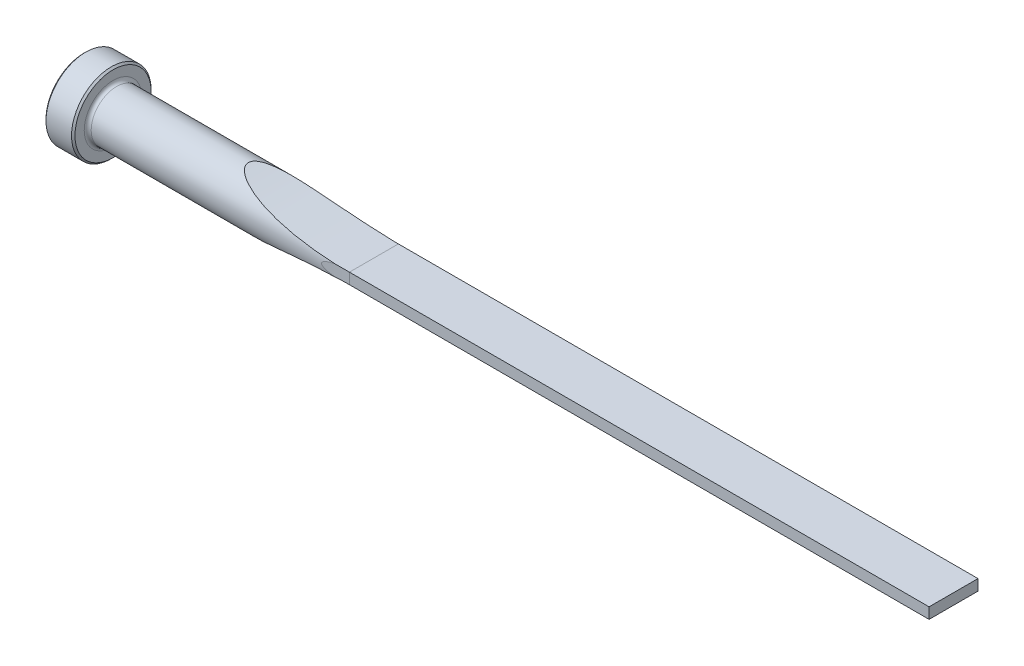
SolidWorks part; units mm, degrees
ref_plane "Front Plane" through (0, 0, 0) normal (0, 0, 1) x (1, 0, 0)
ref_plane "Top Plane" through (0, 0, 0) normal (0, 1, 0) x (1, 0, 0)
ref_plane "Right Plane" through (0, 0, 0) normal (1, 0, 0) x (0, 0, -1)
sketch "Sketch1" plane through (0, 0, 0) normal (0, 0, 1) x (1, 0, 0)
  line L0 (0, 0) -> (175.5286, 0) construction
  line L1 (0, 0) -> (0, 8.7249)
  line L2 (0, 8.7249) -> (6.35, 8.7249)
  line L3 (6.35, 8.7249) -> (6.35, 5.5562)
  line L4 (6.35, 5.5562) -> (190.5, 5.5562)
  line L5 (190.5, 5.5562) -> (190.5, 0)
  line L6 (190.5, 0) -> (0, 0)
  dimension "D1" = 190.5
  dimension "D2" = 17.4498
  dimension "D3" = 11.1125
  dimension "D4" = 6.35
revolve "Revolve1" add sketch "Sketch1" angle 360 about L0
sketch "Sketch2" plane through (0, 0, 0) normal (0, 0, 1) x (1, 0, 0)
  line L0 (190.5, 5.5562) -> (190.5, 1.1938)
  line L1 (190.5, -5.5562) -> (190.5, 5.5562) construction
  line L2 (190.5, 1.1938) -> (63.5, 1.1938)
  line L3 (190.5, 5.5562) -> (6.35, 5.5562) construction
  line L4 (35.9934, 5.5562) -> (190.5, 5.5562)
  line L5 (166.0833, 0) -> (153.1705, 0) construction
  arc A0 (63.5, 1.1938) -> (35.9934, 5.5562) centre (63.5, 90.0938) cw
  dimension "D1" = 88.9
  dimension "D3" = 127
  dimension "D2" = 2.3876
  dimension "D4" = 27.5066
extrude "Cut-Extrude1" cut sketch "Sketch2" against normal through all both and the other way through all
mirror "Mirror1" about plane through (0, 0, 0) normal (0, 1, 0) of "Cut-Extrude1"
sketch "Sketch3" plane through (0, 0, 0) normal (0, 1, 0) x (1, 0, 0)
  line L0 (190.5, 5.5562) -> (190.5, 5.3594)
  line L1 (190.5, 5.4265) -> (190.5, -5.4265) construction
  line L2 (190.5, 5.3594) -> (63.5, 5.3594)
  line L3 (190.5, 5.5562) -> (6.35, 5.5562) construction
  line L4 (57.5872, 5.5562) -> (190.5, 5.5562)
  line L5 (163.4716, 0) -> (166.2513, 0) construction
  line L6 (63.5, 5.4265) -> (63.5, -5.4265) construction
  arc A0 (63.5, 5.3594) -> (57.5872, 5.5562) centre (63.5, 94.2594) cw
  dimension "D2" = 88.9
  dimension "D1" = 10.7188
extrude "Cut-Extrude2" cut sketch "Sketch3" against normal through all both and the other way through all
mirror "Mirror2" about plane through (0, 0, 0) normal (0, 0, 1) of "Cut-Extrude2"
fillet "Fillet1" radius 0.762 1 edges at (6.35, 0, 5.5562)
chamfer "Chamfer1" distance 0.381 angle 45 2 edges at (0, 0, 8.7249) (6.35, 0, 8.7249)
